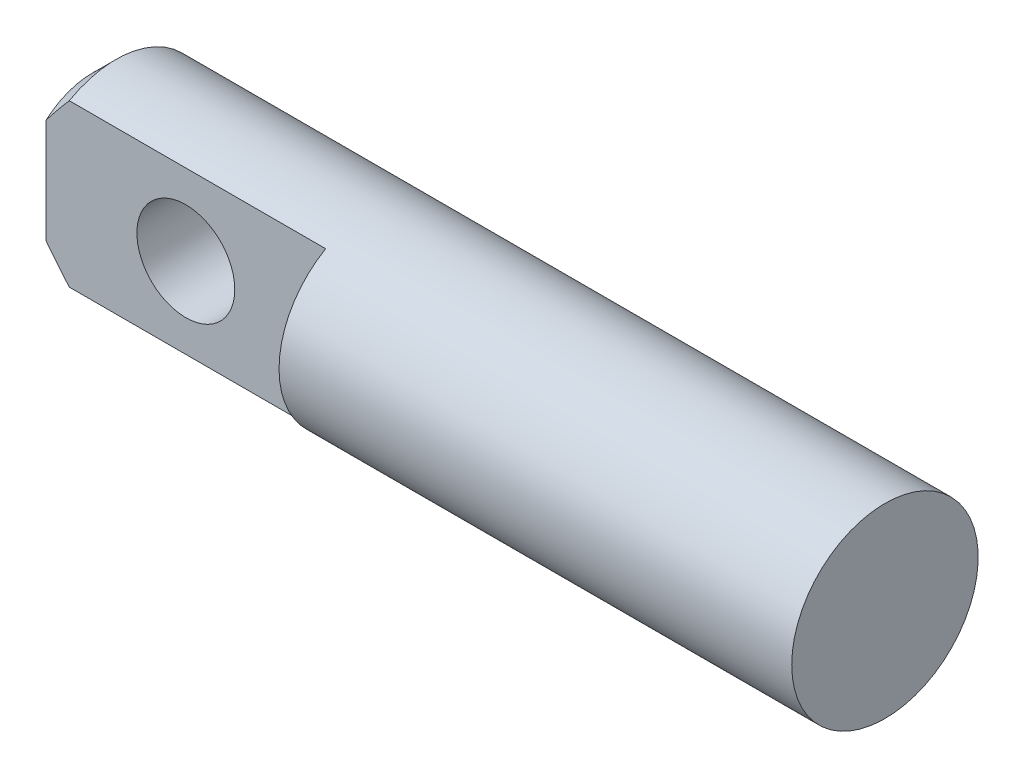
SolidWorks part; units mm, degrees
ref_plane "Front Plane" through (0, 0, 0) normal (0, 0, 1) x (1, 0, 0)
ref_plane "Top Plane" through (0, 0, 0) normal (0, 1, 0) x (1, 0, 0)
ref_plane "Right Plane" through (0, 0, 0) normal (1, 0, 0) x (0, 0, -1)
sketch "Sketch1" plane through (0, 0, 0) normal (0, 0, 1) x (1, 0, 0)
  line L0 (0, 0) -> (17, 0) construction
  line L1 (0, 0) -> (0, 1.5)
  line L2 (0.5, 2) -> (17, 2)
  line L3 (17, 2) -> (17, 0)
  line L4 (0, 0) -> (17, 0)
  line L5 (0, 1.5) -> (0.5, 2)
  point P3 (0, 2)
  dimension "A" = 17
  dimension "D2" = 4
revolve "Revolve1" add sketch "Sketch1" angle 360 about L0
sketch "Sketch2" plane through (0, 0, 0) normal (-1, 0, 0) x (0, 0, 1)
  line L0 (1, 1.7321) -> (1, -1.7321)
  arc A0 (1, -1.7321) -> (1, 1.7321) centre (0, 0) ccw
  circle A1 centre (0, 0) radius 2 construction
  dimension "D1" = 3
extrude "Cut-Extrude1" cut sketch "Sketch2" against normal blind 6
sketch "Sketch3" plane through (0, 0, 1) normal (0, 0, 1) x (1, 0, 0)
  line L0 (0, 1.118) -> (0, -1.118) construction
  circle A0 centre (3, 0) radius 1.05
  dimension "D1" = 2.1
  dimension "D2" = 3
extrude "Cut-Extrude2" cut sketch "Sketch3" against normal through all
